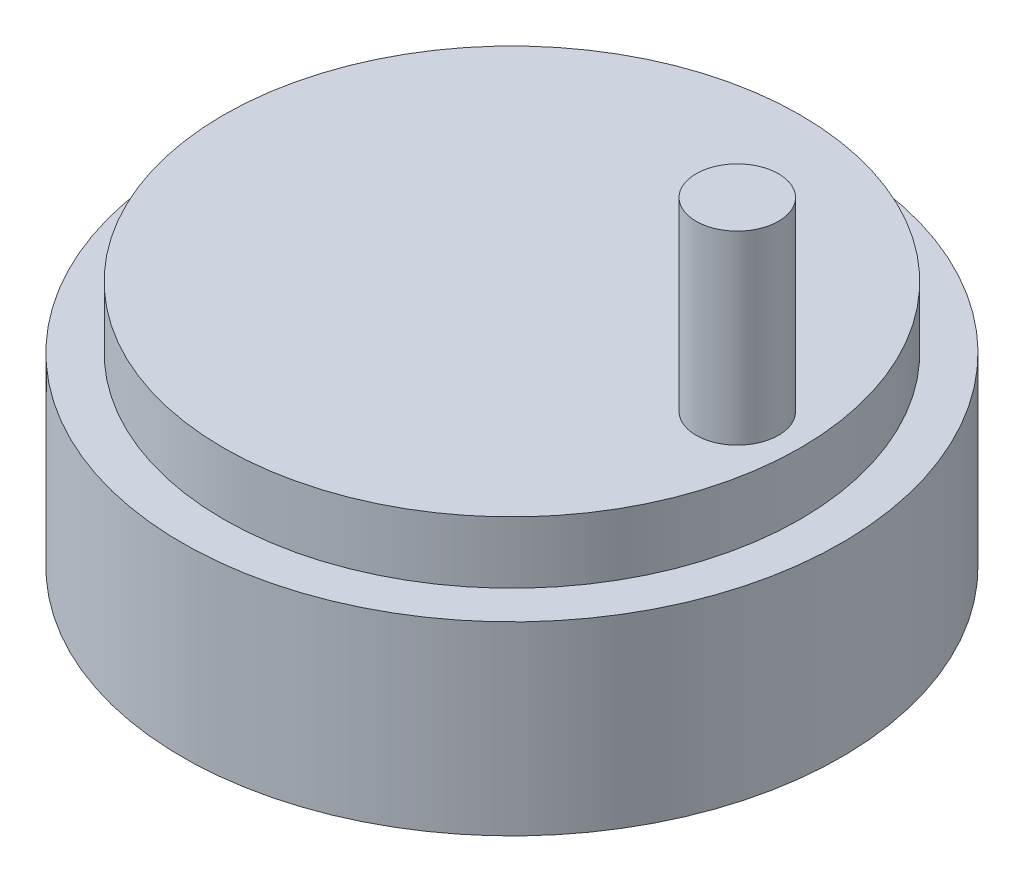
SolidWorks part; units mm, degrees
ref_plane "Front Plane" through (0, 0, 0) normal (0, 0, 1) x (1, 0, 0)
ref_plane "Top Plane" through (0, 0, 0) normal (0, 1, 0) x (1, 0, 0)
ref_plane "Right Plane" through (0, 0, 0) normal (1, 0, 0) x (0, 0, -1)
sketch "Sketch1" plane through (0, 0, 0) normal (0, 1, 0) x (1, 0, 0)
  circle A0 centre (0, 0) radius 7
  dimension "D1" = 14
extrude "Boss-Extrude1" add sketch "Sketch1" along normal blind 6
sketch "Sketch2" plane through (0, 6, 0) normal (0, 1, 0) x (1, 0, 0)
  line L0 (0, 0) -> (5.471, 0) construction
  circle A0 centre (5.471, 0) radius 1
  dimension "D1" = 2
  dimension "D2" = 5.471
extrude "Boss-Extrude2" add sketch "Sketch2" along normal blind 4.5
sketch "Sketch3" plane through (0, 0, 0) normal (0, -1, 0) x (1, 0, 0)
  circle A0 centre (0, 0) radius 8
  dimension "D1" = 16
extrude "Boss-Extrude3" add sketch "Sketch3" against normal blind 4.5
